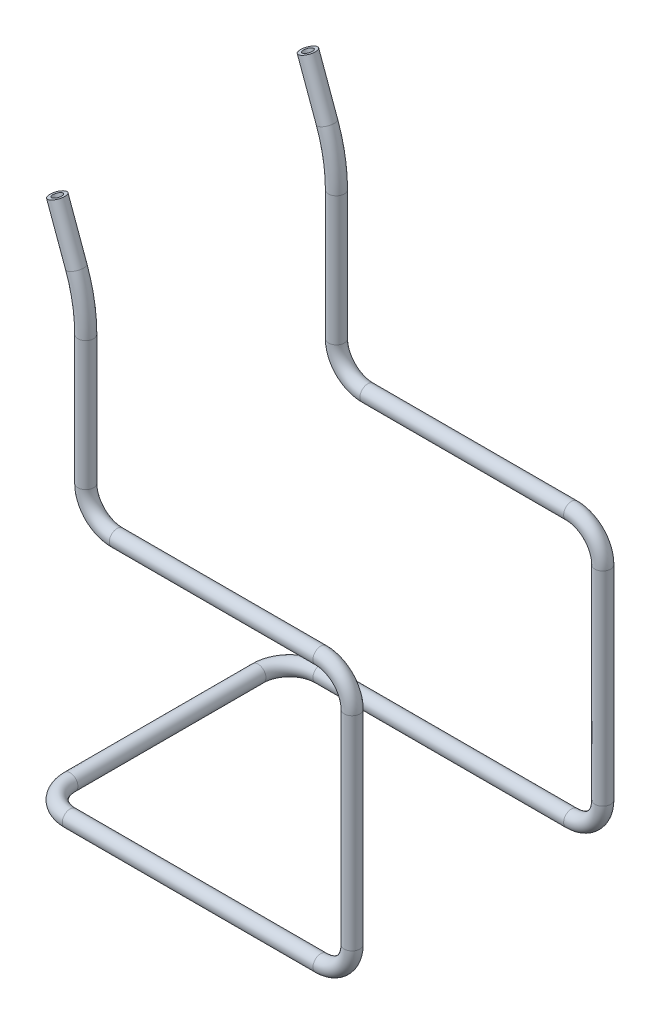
SolidWorks part; units mm, degrees
ref_plane "Front Plane" through (0, 0, 0) normal (0, 0, 1) x (1, 0, 0)
ref_plane "Top Plane" through (0, 0, 0) normal (0, 1, 0) x (1, 0, 0)
ref_plane "Right Plane" through (0, 0, 0) normal (1, 0, 0) x (0, 0, -1)
ref_plane "Plane1" through (0, 0, 40) normal (0, 0, 1) x (1, 0, 0)
sketch3d "3DSketch1"
  line L0 (0, 0, 0) -> (0, 0, 30)
  line L1 (10, 0, 40) -> (90, 0, 40)
  line L2 (100, 10, 40) -> (100, 75, 40)
  line L3 (90, 85, 40) -> (25, 85, 40)
  line L4 (15, 95, 40) -> (15, 136.1837, 40)
  line L5 (11.9846, 153.2847, 40) -> (5.9007, 170, 40)
  arc A0 (0, 0, 30) -> (10, 0, 40) centre (10, 0, 30) ccw
  arc A1 (90, 0, 40) -> (100, 10, 40) centre (90, 10, 40) ccw
  arc A2 (100, 75, 40) -> (90, 85, 40) centre (90, 75, 40) ccw
  arc A3 (25, 85, 40) -> (15, 95, 40) centre (25, 95, 40) ccw
  arc A4 (15, 136.1837, 40) -> (11.9846, 153.2847, 40) centre (-35, 136.1837, 40) ccw
  point P10 (0, 0, 40)
  point P11 (10, 10, 30)
  point P14 (100, 0, 40)
  point P15 (90, 10, 50)
  point P18 (100, 85, 40)
  point P19 (90, 75, 50)
  point P22 (15, 85, 40)
  point P23 (25, 95, 30)
  point P26 (15, 145, 40)
  point P27 (-35, 136.1837, 90)
  dimension "D1" = 10
  dimension "D2" = 50
  dimension "D3" = 40
  dimension "D4" = 100
  dimension "D5" = 85
  dimension "D6" = 85
  dimension "D7" = 60
  dimension "D8" = 170
  dimension "D9" = 20
sketch "Sketch1" plane through (0, 0, 0) normal (0, 0, 1) x (1, 0, 0)
  circle A0 centre (0, 0) radius 2.5
  dimension "D1" = 5
sweep "Sweep-Thin1" add profiles "Sketch1" path "3DSketch1" parameters "D1"=1
mirror "Mirror1" about plane through (0, 0, 0) normal (0, 0, 1) of "Sweep-Thin1"
